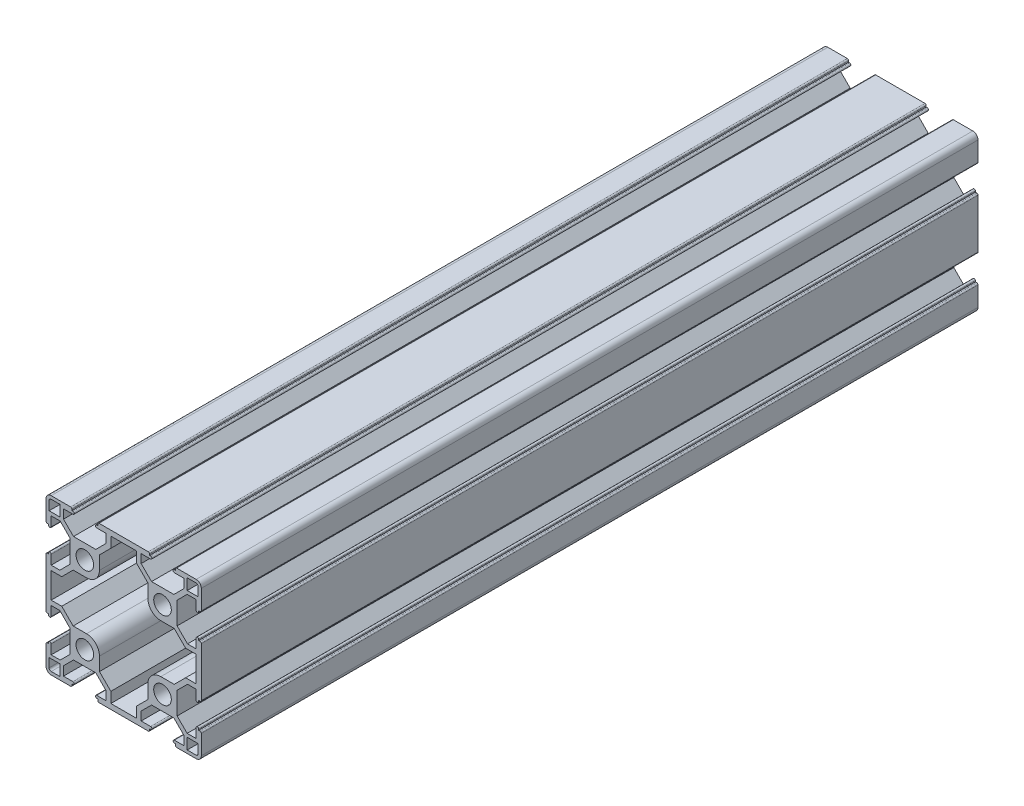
SolidWorks part; units mm, degrees
ref_plane "前视基准面" through (0, 0, 0) normal (0, 0, 1) x (1, 0, 0)
ref_plane "上视基准面" through (0, 0, 0) normal (0, 1, 0) x (1, 0, 0)
ref_plane "右视基准面" through (0, 0, 0) normal (1, 0, 0) x (0, 0, -1)
sketch "Model" plane through (0, 0, 0) normal (0, 0, 1) x (1, 0, 0)
  line L0 (27670.037, -9636.7353) -> (27665.787, -9636.7353)
  line L1 (27665.787, -9636.7353) -> (27665.787, -9632.4853)
  line L2 (27665.787, -9632.4853) -> (27669.237, -9632.4853)
  line L3 (27670.037, -9633.2853) -> (27670.037, -9636.7353)
  line L4 (27665.787, -9685.8353) -> (27670.037, -9685.8353)
  line L5 (27670.037, -9685.8353) -> (27670.037, -9689.2853)
  line L6 (27669.237, -9690.0853) -> (27665.787, -9690.0853)
  line L7 (27665.787, -9690.0853) -> (27665.787, -9685.8353)
  line L8 (27669.237, -9656.3353) -> (27669.237, -9666.2353)
  line L9 (27669.237, -9666.2353) -> (27665.1557, -9666.2353)
  line L10 (27665.1557, -9666.2353) -> (27660.7557, -9670.6353)
  line L11 (27660.7557, -9670.6353) -> (27655.587, -9670.6353)
  line L12 (27650.587, -9675.6353) -> (27650.587, -9680.8039)
  line L13 (27650.587, -9680.8039) -> (27646.187, -9685.2039)
  line L14 (27646.187, -9685.2039) -> (27646.187, -9689.2853)
  line L15 (27646.187, -9689.2853) -> (27636.287, -9689.2853)
  line L16 (27636.287, -9689.2853) -> (27636.287, -9685.2039)
  line L17 (27636.287, -9685.2039) -> (27631.887, -9680.8039)
  line L18 (27631.887, -9680.8039) -> (27631.887, -9675.6353)
  line L19 (27626.887, -9670.6353) -> (27621.7184, -9670.6353)
  line L20 (27621.7184, -9670.6353) -> (27617.3184, -9666.2353)
  line L21 (27617.3184, -9666.2353) -> (27613.237, -9666.2353)
  line L22 (27613.237, -9666.2353) -> (27613.237, -9656.3353)
  line L23 (27613.237, -9656.3353) -> (27617.3184, -9656.3353)
  line L24 (27617.3184, -9656.3353) -> (27621.7184, -9651.9353)
  line L25 (27621.7184, -9651.9353) -> (27626.887, -9651.9353)
  line L26 (27631.887, -9646.9353) -> (27631.887, -9641.7666)
  line L27 (27631.887, -9641.7666) -> (27636.287, -9637.3666)
  line L28 (27636.287, -9637.3666) -> (27636.287, -9633.2853)
  line L29 (27636.287, -9633.2853) -> (27646.187, -9633.2853)
  line L30 (27646.187, -9633.2853) -> (27646.187, -9637.3666)
  line L31 (27646.187, -9637.3666) -> (27650.587, -9641.7666)
  line L32 (27650.587, -9641.7666) -> (27650.587, -9646.9353)
  line L33 (27655.587, -9651.9353) -> (27660.7557, -9651.9353)
  line L34 (27660.7557, -9651.9353) -> (27665.1557, -9656.3353)
  line L35 (27665.1557, -9656.3353) -> (27669.237, -9656.3353)
  line L36 (27612.437, -9685.8353) -> (27616.687, -9685.8353)
  line L37 (27616.687, -9685.8353) -> (27616.687, -9690.0853)
  line L38 (27616.687, -9690.0853) -> (27613.237, -9690.0853)
  line L39 (27612.437, -9689.2853) -> (27612.437, -9685.8353)
  line L40 (27616.687, -9636.7353) -> (27612.437, -9636.7353)
  line L41 (27612.437, -9636.7353) -> (27612.437, -9633.2853)
  line L42 (27613.237, -9632.4853) -> (27616.687, -9632.4853)
  line L43 (27616.687, -9632.4853) -> (27616.687, -9636.7353)
  line L44 (27670.237, -9671.2853) -> (27670.737, -9671.2853)
  line L45 (27671.237, -9670.7853) -> (27671.237, -9651.7853)
  line L46 (27670.737, -9651.2853) -> (27670.237, -9651.2853)
  line L47 (27670.237, -9651.2853) -> (27670.237, -9650.8853)
  line L48 (27669.237, -9650.8853) -> (27669.237, -9654.5353)
  line L49 (27669.237, -9654.5353) -> (27665.9013, -9654.5353)
  line L50 (27665.9013, -9654.5353) -> (27661.887, -9650.5211)
  line L51 (27661.887, -9650.5211) -> (27661.887, -9641.9081)
  line L52 (27661.887, -9641.9081) -> (27665.7598, -9638.0353)
  line L53 (27665.7598, -9638.0353) -> (27669.237, -9638.0353)
  line L54 (27669.237, -9638.0353) -> (27669.237, -9641.6853)
  line L55 (27670.237, -9641.6853) -> (27670.237, -9641.2853)
  line L56 (27670.237, -9641.2853) -> (27670.737, -9641.2853)
  line L57 (27671.237, -9640.7853) -> (27671.237, -9633.2853)
  line L58 (27669.237, -9631.2853) -> (27661.737, -9631.2853)
  line L59 (27661.237, -9631.7853) -> (27661.237, -9632.2853)
  line L60 (27661.237, -9632.2853) -> (27660.837, -9632.2853)
  line L61 (27660.837, -9633.2853) -> (27664.487, -9633.2853)
  line L62 (27664.487, -9633.2853) -> (27664.487, -9636.7625)
  line L63 (27664.487, -9636.7625) -> (27660.6142, -9640.6353)
  line L64 (27660.6142, -9640.6353) -> (27652.0013, -9640.6353)
  line L65 (27652.0013, -9640.6353) -> (27647.987, -9636.6211)
  line L66 (27647.987, -9636.6211) -> (27647.987, -9633.2853)
  line L67 (27647.987, -9633.2853) -> (27651.637, -9633.2853)
  line L68 (27651.637, -9632.2853) -> (27651.237, -9632.2853)
  line L69 (27651.237, -9632.2853) -> (27651.237, -9631.7853)
  line L70 (27650.737, -9631.2853) -> (27631.737, -9631.2853)
  line L71 (27631.237, -9631.7853) -> (27631.237, -9632.2853)
  line L72 (27631.237, -9632.2853) -> (27630.837, -9632.2853)
  line L73 (27630.837, -9633.2853) -> (27634.487, -9633.2853)
  line L74 (27634.487, -9633.2853) -> (27634.487, -9636.6211)
  line L75 (27634.487, -9636.6211) -> (27630.4728, -9640.6353)
  line L76 (27630.4728, -9640.6353) -> (27621.8598, -9640.6353)
  line L77 (27621.8598, -9640.6353) -> (27617.987, -9636.7625)
  line L78 (27617.987, -9636.7625) -> (27617.987, -9633.2853)
  line L79 (27617.987, -9633.2853) -> (27621.637, -9633.2853)
  line L80 (27621.637, -9632.2853) -> (27621.237, -9632.2853)
  line L81 (27621.237, -9632.2853) -> (27621.237, -9631.7853)
  line L82 (27620.737, -9631.2853) -> (27613.237, -9631.2853)
  line L83 (27611.237, -9633.2853) -> (27611.237, -9640.7853)
  line L84 (27611.737, -9641.2853) -> (27612.237, -9641.2853)
  line L85 (27612.237, -9641.2853) -> (27612.237, -9641.6853)
  line L86 (27613.237, -9641.6853) -> (27613.237, -9638.0353)
  line L87 (27613.237, -9638.0353) -> (27616.7142, -9638.0353)
  line L88 (27616.7142, -9638.0353) -> (27620.587, -9641.9081)
  line L89 (27620.587, -9641.9081) -> (27620.587, -9650.5211)
  line L90 (27620.587, -9650.5211) -> (27616.5728, -9654.5353)
  line L91 (27616.5728, -9654.5353) -> (27613.237, -9654.5353)
  line L92 (27613.237, -9654.5353) -> (27613.237, -9650.8853)
  line L93 (27612.237, -9650.8853) -> (27612.237, -9651.2853)
  line L94 (27612.237, -9651.2853) -> (27611.737, -9651.2853)
  line L95 (27611.237, -9651.7853) -> (27611.237, -9670.7853)
  line L96 (27611.737, -9671.2853) -> (27612.237, -9671.2853)
  line L97 (27612.237, -9671.2853) -> (27612.237, -9671.6853)
  line L98 (27613.237, -9671.6853) -> (27613.237, -9668.0353)
  line L99 (27613.237, -9668.0353) -> (27616.5728, -9668.0353)
  line L100 (27616.5728, -9668.0353) -> (27620.587, -9672.0495)
  line L101 (27620.587, -9672.0495) -> (27620.587, -9680.6625)
  line L102 (27620.587, -9680.6625) -> (27616.7142, -9684.5353)
  line L103 (27616.7142, -9684.5353) -> (27613.237, -9684.5353)
  line L104 (27613.237, -9684.5353) -> (27613.237, -9680.8853)
  line L105 (27612.237, -9680.8853) -> (27612.237, -9681.2853)
  line L106 (27612.237, -9681.2853) -> (27611.737, -9681.2853)
  line L107 (27611.237, -9681.7853) -> (27611.237, -9689.2853)
  line L108 (27613.237, -9691.2853) -> (27620.737, -9691.2853)
  line L109 (27621.237, -9690.7853) -> (27621.237, -9690.2853)
  line L110 (27621.237, -9690.2853) -> (27621.637, -9690.2853)
  line L111 (27621.637, -9689.2853) -> (27617.987, -9689.2853)
  line L112 (27617.987, -9689.2853) -> (27617.987, -9685.8081)
  line L113 (27617.987, -9685.8081) -> (27621.8598, -9681.9353)
  line L114 (27621.8598, -9681.9353) -> (27630.4728, -9681.9353)
  line L115 (27630.4728, -9681.9353) -> (27634.487, -9685.9495)
  line L116 (27634.487, -9685.9495) -> (27634.487, -9689.2853)
  line L117 (27634.487, -9689.2853) -> (27630.837, -9689.2853)
  line L118 (27630.837, -9690.2853) -> (27631.237, -9690.2853)
  line L119 (27631.237, -9690.2853) -> (27631.237, -9690.7853)
  line L120 (27631.737, -9691.2853) -> (27650.737, -9691.2853)
  line L121 (27651.237, -9690.7853) -> (27651.237, -9690.2853)
  line L122 (27651.237, -9690.2853) -> (27651.637, -9690.2853)
  line L123 (27651.637, -9689.2853) -> (27647.987, -9689.2853)
  line L124 (27647.987, -9689.2853) -> (27647.987, -9685.9495)
  line L125 (27647.987, -9685.9495) -> (27652.0013, -9681.9353)
  line L126 (27652.0013, -9681.9353) -> (27660.6142, -9681.9353)
  line L127 (27660.6142, -9681.9353) -> (27664.487, -9685.8081)
  line L128 (27664.487, -9685.8081) -> (27664.487, -9689.2853)
  line L129 (27664.487, -9689.2853) -> (27660.837, -9689.2853)
  line L130 (27660.837, -9690.2853) -> (27661.237, -9690.2853)
  line L131 (27661.237, -9690.2853) -> (27661.237, -9690.7853)
  line L132 (27661.737, -9691.2853) -> (27669.237, -9691.2853)
  line L133 (27671.237, -9689.2853) -> (27671.237, -9681.7853)
  line L134 (27670.737, -9681.2853) -> (27670.237, -9681.2853)
  line L135 (27670.237, -9681.2853) -> (27670.237, -9680.8853)
  line L136 (27669.237, -9680.8853) -> (27669.237, -9684.5353)
  line L137 (27669.237, -9684.5353) -> (27665.7598, -9684.5353)
  line L138 (27665.7598, -9684.5353) -> (27661.887, -9680.6625)
  line L139 (27661.887, -9680.6625) -> (27661.887, -9672.0495)
  line L140 (27661.887, -9672.0495) -> (27665.9013, -9668.0353)
  line L141 (27665.9013, -9668.0353) -> (27669.237, -9668.0353)
  line L142 (27669.237, -9668.0353) -> (27669.237, -9671.6853)
  line L143 (27670.237, -9671.6853) -> (27670.237, -9671.2853)
  arc A0 (27670.037, -9633.2853) -> (27669.237, -9632.4853) centre (27669.237, -9633.2853) ccw
  arc A1 (27669.237, -9690.0853) -> (27670.037, -9689.2853) centre (27669.237, -9689.2853) ccw
  circle A2 centre (27656.237, -9646.2853) radius 3.4
  circle A3 centre (27656.237, -9676.2853) radius 3.4
  arc A4 (27655.587, -9670.6353) -> (27650.587, -9675.6353) centre (27655.587, -9675.6353) ccw
  arc A5 (27631.887, -9675.6353) -> (27626.887, -9670.6353) centre (27626.887, -9675.6353) ccw
  arc A6 (27626.887, -9651.9353) -> (27631.887, -9646.9353) centre (27626.887, -9646.9353) ccw
  arc A7 (27650.587, -9646.9353) -> (27655.587, -9651.9353) centre (27655.587, -9646.9353) ccw
  circle A8 centre (27626.237, -9676.2853) radius 3.4
  circle A9 centre (27626.237, -9646.2853) radius 3.4
  arc A10 (27612.437, -9689.2853) -> (27613.237, -9690.0853) centre (27613.237, -9689.2853) ccw
  arc A11 (27613.237, -9632.4853) -> (27612.437, -9633.2853) centre (27613.237, -9633.2853) ccw
  arc A12 (27670.737, -9671.2853) -> (27671.237, -9670.7853) centre (27670.737, -9670.7853) ccw
  arc A13 (27671.237, -9651.7853) -> (27670.737, -9651.2853) centre (27670.737, -9651.7853) ccw
  arc A14 (27670.237, -9650.8853) -> (27669.737, -9650.3853) centre (27669.737, -9650.8853) ccw
  arc A15 (27669.737, -9650.3853) -> (27669.237, -9650.8853) centre (27669.737, -9650.8853) ccw
  arc A16 (27669.237, -9641.6853) -> (27669.737, -9642.1853) centre (27669.737, -9641.6853) ccw
  arc A17 (27669.737, -9642.1853) -> (27670.237, -9641.6853) centre (27669.737, -9641.6853) ccw
  arc A18 (27670.737, -9641.2853) -> (27671.237, -9640.7853) centre (27670.737, -9640.7853) ccw
  arc A19 (27671.237, -9633.2853) -> (27669.237, -9631.2853) centre (27669.237, -9633.2853) ccw
  arc A20 (27661.737, -9631.2853) -> (27661.237, -9631.7853) centre (27661.737, -9631.7853) ccw
  arc A21 (27660.837, -9632.2853) -> (27660.337, -9632.7853) centre (27660.837, -9632.7853) ccw
  arc A22 (27660.337, -9632.7853) -> (27660.837, -9633.2853) centre (27660.837, -9632.7853) ccw
  arc A23 (27651.637, -9633.2853) -> (27652.137, -9632.7853) centre (27651.637, -9632.7853) ccw
  arc A24 (27652.137, -9632.7853) -> (27651.637, -9632.2853) centre (27651.637, -9632.7853) ccw
  arc A25 (27651.237, -9631.7853) -> (27650.737, -9631.2853) centre (27650.737, -9631.7853) ccw
  arc A26 (27631.737, -9631.2853) -> (27631.237, -9631.7853) centre (27631.737, -9631.7853) ccw
  arc A27 (27630.837, -9632.2853) -> (27630.337, -9632.7853) centre (27630.837, -9632.7853) ccw
  arc A28 (27630.337, -9632.7853) -> (27630.837, -9633.2853) centre (27630.837, -9632.7853) ccw
  arc A29 (27621.637, -9633.2853) -> (27622.137, -9632.7853) centre (27621.637, -9632.7853) ccw
  arc A30 (27622.137, -9632.7853) -> (27621.637, -9632.2853) centre (27621.637, -9632.7853) ccw
  arc A31 (27621.237, -9631.7853) -> (27620.737, -9631.2853) centre (27620.737, -9631.7853) ccw
  arc A32 (27613.237, -9631.2853) -> (27611.237, -9633.2853) centre (27613.237, -9633.2853) ccw
  arc A33 (27611.237, -9640.7853) -> (27611.737, -9641.2853) centre (27611.737, -9640.7853) ccw
  arc A34 (27612.237, -9641.6853) -> (27612.737, -9642.1853) centre (27612.737, -9641.6853) ccw
  arc A35 (27612.737, -9642.1853) -> (27613.237, -9641.6853) centre (27612.737, -9641.6853) ccw
  arc A36 (27613.237, -9650.8853) -> (27612.737, -9650.3853) centre (27612.737, -9650.8853) ccw
  arc A37 (27612.737, -9650.3853) -> (27612.237, -9650.8853) centre (27612.737, -9650.8853) ccw
  arc A38 (27611.737, -9651.2853) -> (27611.237, -9651.7853) centre (27611.737, -9651.7853) ccw
  arc A39 (27611.237, -9670.7853) -> (27611.737, -9671.2853) centre (27611.737, -9670.7853) ccw
  arc A40 (27612.237, -9671.6853) -> (27612.737, -9672.1853) centre (27612.737, -9671.6853) ccw
  arc A41 (27612.737, -9672.1853) -> (27613.237, -9671.6853) centre (27612.737, -9671.6853) ccw
  arc A42 (27613.237, -9680.8853) -> (27612.737, -9680.3853) centre (27612.737, -9680.8853) ccw
  arc A43 (27612.737, -9680.3853) -> (27612.237, -9680.8853) centre (27612.737, -9680.8853) ccw
  arc A44 (27611.737, -9681.2853) -> (27611.237, -9681.7853) centre (27611.737, -9681.7853) ccw
  arc A45 (27611.237, -9689.2853) -> (27613.237, -9691.2853) centre (27613.237, -9689.2853) ccw
  arc A46 (27620.737, -9691.2853) -> (27621.237, -9690.7853) centre (27620.737, -9690.7853) ccw
  arc A47 (27621.637, -9690.2853) -> (27622.137, -9689.7853) centre (27621.637, -9689.7853) ccw
  arc A48 (27622.137, -9689.7853) -> (27621.637, -9689.2853) centre (27621.637, -9689.7853) ccw
  arc A49 (27630.837, -9689.2853) -> (27630.337, -9689.7853) centre (27630.837, -9689.7853) ccw
  arc A50 (27630.337, -9689.7853) -> (27630.837, -9690.2853) centre (27630.837, -9689.7853) ccw
  arc A51 (27631.237, -9690.7853) -> (27631.737, -9691.2853) centre (27631.737, -9690.7853) ccw
  arc A52 (27650.737, -9691.2853) -> (27651.237, -9690.7853) centre (27650.737, -9690.7853) ccw
  arc A53 (27651.637, -9690.2853) -> (27652.137, -9689.7853) centre (27651.637, -9689.7853) ccw
  arc A54 (27652.137, -9689.7853) -> (27651.637, -9689.2853) centre (27651.637, -9689.7853) ccw
  arc A55 (27660.837, -9689.2853) -> (27660.337, -9689.7853) centre (27660.837, -9689.7853) ccw
  arc A56 (27660.337, -9689.7853) -> (27660.837, -9690.2853) centre (27660.837, -9689.7853) ccw
  arc A57 (27661.237, -9690.7853) -> (27661.737, -9691.2853) centre (27661.737, -9690.7853) ccw
  arc A58 (27669.237, -9691.2853) -> (27671.237, -9689.2853) centre (27669.237, -9689.2853) ccw
  arc A59 (27671.237, -9681.7853) -> (27670.737, -9681.2853) centre (27670.737, -9681.7853) ccw
  arc A60 (27670.237, -9680.8853) -> (27669.737, -9680.3853) centre (27669.737, -9680.8853) ccw
  arc A61 (27669.737, -9680.3853) -> (27669.237, -9680.8853) centre (27669.737, -9680.8853) ccw
  arc A62 (27669.237, -9671.6853) -> (27669.737, -9672.1853) centre (27669.737, -9671.6853) ccw
  arc A63 (27669.737, -9672.1853) -> (27670.237, -9671.6853) centre (27669.737, -9671.6853) ccw
extrude "凸台-拉伸1" add sketch "Model" along normal blind 300
